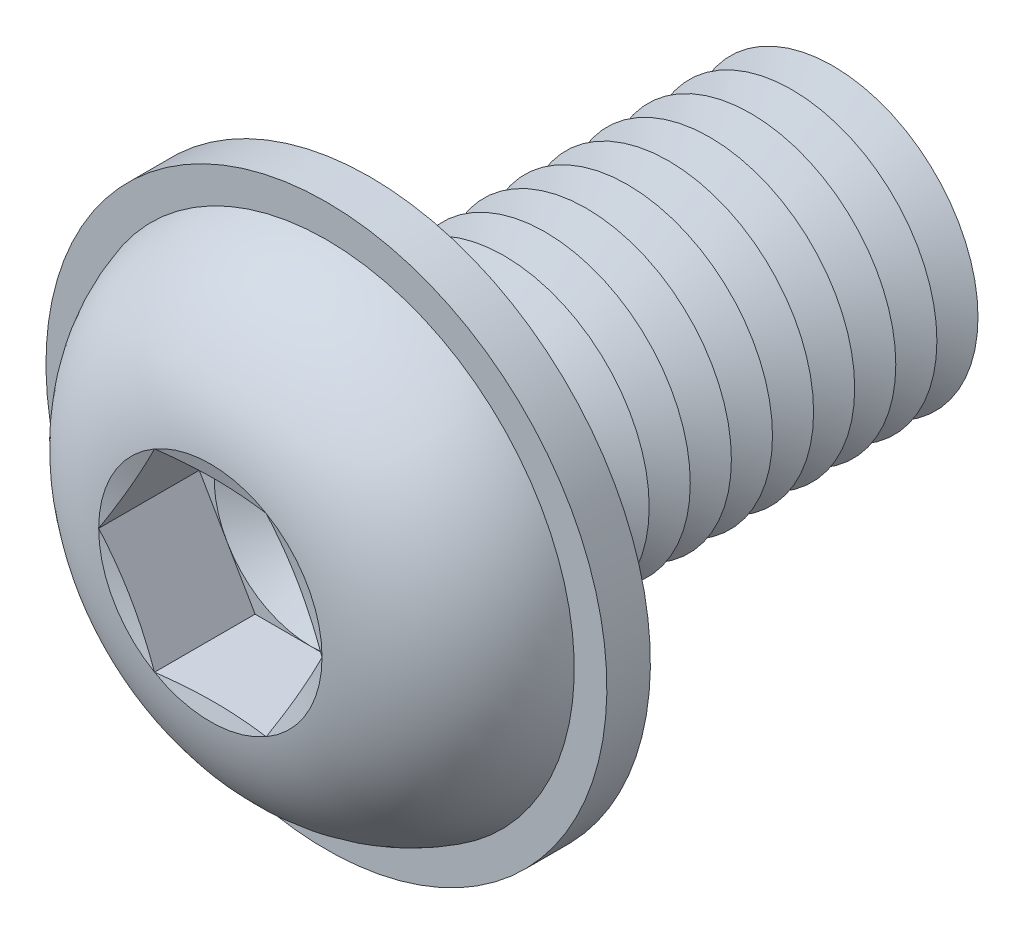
SolidWorks part; units mm, degrees
ref_plane "Front Plane" through (0, 0, 0) normal (0, 0, 1) x (1, 0, 0)
ref_plane "Top Plane" through (0, 0, 0) normal (0, 1, 0) x (1, 0, 0)
ref_plane "Right Plane" through (0, 0, 0) normal (1, 0, 0) x (0, 0, -1)
sketch "Sketch1" plane through (0, 0, 0) normal (1, 0, 0) x (0, 0, -1)
  line L0 (0, 6) -> (0, 10.5)
  line L3 (0, 6) -> (20, 6)
  line L4 (20, 6) -> (20, 0)
  line L5 (20, 0) -> (-6.6, 0) construction
  line L6 (-6.6, 0) -> (20, 0)
  line L7 (-6.6, 4.6188) -> (-6.6, 2.3094) construction
  line L8 (-6.6, 2.3094) -> (-6.6, 0)
  line L9 (-6.6, 4.6188) -> (-5.9812, 2.3094)
  line L10 (-5.9812, 2.3094) -> (-6.6, 2.3094)
  line L11 (20, 0) -> (22.7481, 0) construction
  line L12 (0, 10.5) -> (-6.6, 10.5) construction
  arc A1 (0, 10.5) -> (-6.6, 4.6188) centre (0, 3.8561) ccw
  point P8 (20, 3)
  dimension "D1" = 21
  dimension "D2" = 12
  dimension "D3" = 6.6
  dimension "D4" = 9.2376
  dimension "D5" = 20
  dimension "D6" = 15
revolve "Revolve1" add sketch "Sketch1" angle 360 about L5
fillet "Fillet1" radius 0.85 1 edges at (0, 6, 0)
sketch "Sketch2" plane through (0, 0, 0) normal (1, 0, 0) x (0, 0, -1)
  line L0 (19.15, 6) -> (20.85, 6)
  line L1 (20, 6) -> (0.85, 6) construction
  line L2 (20.85, 6) -> (20, 4.5278)
  line L3 (20, -6) -> (20, 6) construction
  line L4 (20, 4.5278) -> (19.15, 6)
  dimension "D1" = 1.7
revolve "Cut-Revolve1" cut sketch "Sketch2" angle 360 about axis through (0, 0, -20) along (0, 0, -1)
pattern_linear "LPattern1" count 11 spacing 1.7 along (0, 0, 1) of "Cut-Revolve1"
sketch "Sketch3" plane through (0, 0, 6.6) normal (0, 0, 1) x (1, 0, 0)
  line L7 (2.3094, 4) -> (-2.3094, 4)
  line L8 (-2.3094, 4) -> (-4.6188, 0)
  line L9 (-4.6188, 0) -> (-2.3094, -4)
  line L10 (-2.3094, -4) -> (2.3094, -4)
  line L11 (2.3094, -4) -> (4.6188, 0)
  line L12 (4.6188, 0) -> (2.3094, 4)
  circle A0 centre (0, 0) radius 4 construction
  circle A3 centre (0, 0) radius 4.6188 construction
extrude "Cut-Extrude1" cut sketch "Sketch3" against normal blind 4.16
sketch "Sketch4" plane through (0, 0, 2.44) normal (0, 0, 1) x (1, 0, 0)
  line L1 (2.3094, 4) -> (-2.3094, 4) construction
  circle A0 centre (0, 0) radius 4
extrude "Cut-Extrude2" cut sketch "Sketch4" against normal through all draft 60
sketch "Sketch5" plane through (0, 0, 0) normal (0, 0, -1) x (-1, 0, 0)
  circle A0 centre (0, 0) radius 11.6
  circle A1 centre (0, 0) radius 6.85
  circle A2 centre (0, 0) radius 6.85 construction
  dimension "D1" = 23.2
extrude "Boss-Extrude1" add sketch "Sketch5" against normal blind 1.8
